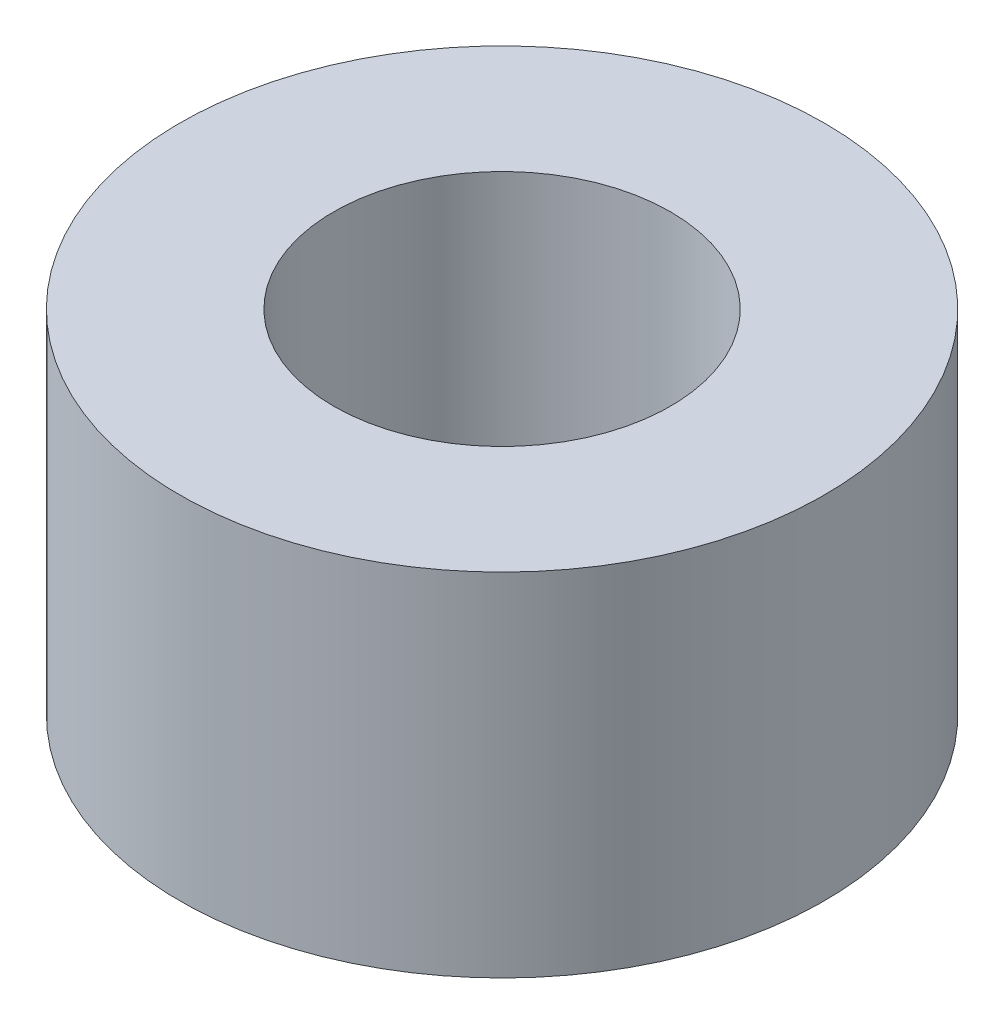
SolidWorks part; units mm, degrees
ref_plane "Front Plane" through (0, 0, 0) normal (0, 0, 1) x (1, 0, 0)
ref_plane "Top Plane" through (0, 0, 0) normal (0, 1, 0) x (1, 0, 0)
ref_plane "Right Plane" through (0, 0, 0) normal (1, 0, 0) x (0, 0, -1)
sketch "Sketch1" plane through (0, 0, 0) normal (0, 1, 0) x (1, 0, 0)
  circle A0 centre (0, 0) radius 17.4625
  dimension "D1" = 34.925
extrude "Boss-Extrude1" add sketch "Sketch1" along normal blind 19.05
hole_wizard "23/32 (0.71875) Diameter Hole1" positions "Sketch4" profile "Sketch3" hole size "23/32" standard "Ansi Inch"
sketch "Sketch4" plane through (0, 19.05, 0) normal (0, 1, 0) x (-1, 0, 0)
  point P0 (0, 0)
sketch "Sketch3" plane through (0, 19.05, 0) normal (1, 0, 0) x (0, 0, 1)
  line L0 (0, 0) -> (0, 19.05)
  line L1 (0, 19.05) -> (9.1281, 19.05)
  line L2 (9.1281, 19.05) -> (9.1281, 0)
  line L5 (9.1281, 0) -> (0, 0)
  line L11 (0, -6.35) -> (0, 107.95) construction
  dimension "Thru Hole Dia." = 18.2562
  dimension "Thru Hole Depth" = 19.05
